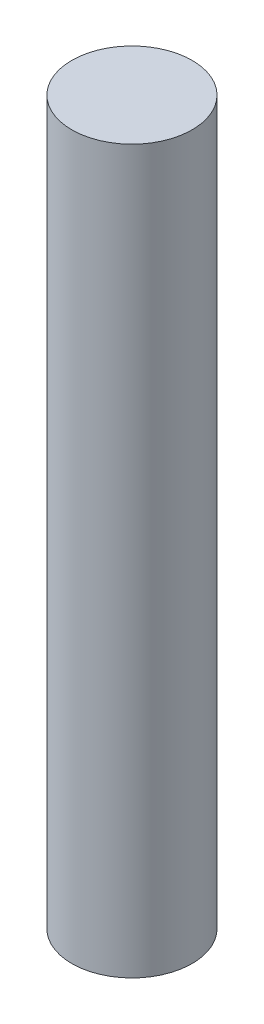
SolidWorks part; units mm, degrees
ref_plane "Plan de face" through (0, 0, 0) normal (0, 0, 1) x (1, 0, 0)
ref_plane "Plan de dessus" through (0, 0, 0) normal (0, 1, 0) x (1, 0, 0)
ref_plane "Plan de droite" through (0, 0, 0) normal (1, 0, 0) x (0, 0, -1)
sketch "Esquisse1" plane through (0, 0, 0) normal (0, 0, 1) x (1, 0, 0)
  line L0 (0, 119.822) -> (0, -30.178) construction
  line L2 (12.5, -30.178) -> (0, -30.178)
  line L3 (12.5, -30.178) -> (12.5, 119.822)
  line L4 (12.5, 119.822) -> (0, 119.822)
  line L5 (0, -30.178) -> (0, 119.822)
  dimension "D1" = 12.5
  dimension "D2" = 150
revolve "Révolution1" add sketch "Esquisse1" angle 360 about L0
